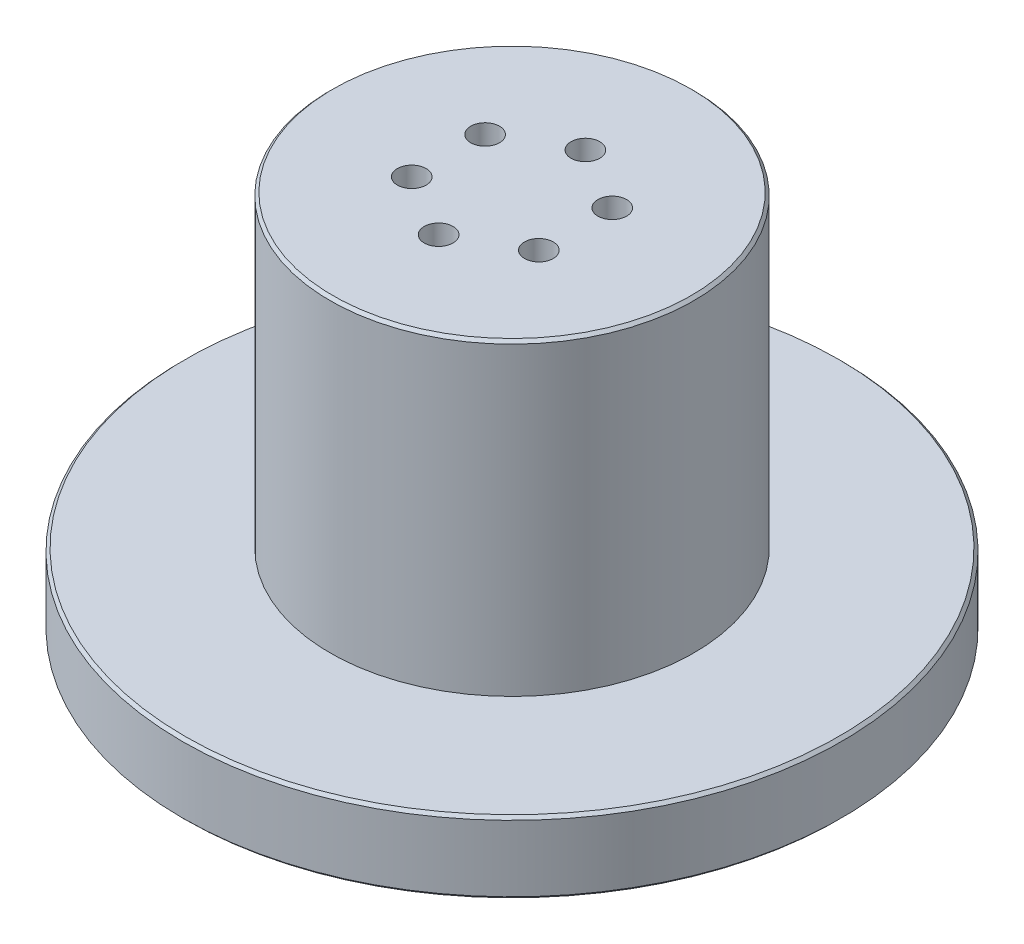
SolidWorks part; units mm, degrees
ref_plane "Plan1" through (0, 0, 0) normal (0, 0, 1) x (1, 0, 0)
ref_plane "Plan2" through (0, 0, 0) normal (0, 1, 0) x (1, 0, 0)
ref_plane "Plan3" through (0, 0, 0) normal (1, 0, 0) x (0, 0, -1)
sketch "Esquisse1" plane through (0, 0, 0) normal (0, 0, 1) x (1, 0, 0)
  line L0 (0, -37.4669) -> (0, 101.0404) construction
  line L1 (0, -50) -> (0, 50) construction
  line L2 (0, 0) -> (-57.25, 0)
  line L3 (-57.25, 0) -> (-57.25, 12.5)
  line L4 (-57.25, 12.5) -> (-31.6, 12.5)
  line L5 (-31.6, 12.5) -> (-31.6, 66)
  line L6 (-31.6, 66) -> (0, 66)
  line L7 (0, 66) -> (0, 0)
  line L8 (50, 0) -> (-50, 0) construction
  dimension "D1" = 114.5
  dimension "D2" = 12.5
  dimension "D3" = 63.2
  dimension "D4" = 66
revolve "Révolution1" add sketch "Esquisse1" angle 360 about L0
hole_wizard "Trou taraudé M61" positions "Esquisse3" profile "Esquisse2" tap size "M6" standard "ISO"
sketch "Esquisse3" plane through (0, 66, 0) normal (0, 1, 0) x (-1, 0, 0)
  circle A0 centre (0, 0) radius 12.75
  point P0 (0, 12.75)
  dimension "D1" = 25.5
sketch "Esquisse2" plane through (0, 66, 12.75) normal (1, 0, 0) x (0, 0, 1)
  line L0 (0, 0) -> (0, 18.5022)
  line L1 (0, 18.5022) -> (2.5, 17)
  line L2 (2.5, 17) -> (2.5, 0)
  line L5 (2.5, 0) -> (0, 0)
  line L10 (0, 18.5022) -> (-2.5, 17) construction
  line L11 (0, -6.35) -> (0, 107.95) construction
  dimension "Diamètre du trou pour taraudage" = 5
  dimension "Profondeur du trou pour taraudage" = 17
  dimension "Angle de pointe" = 118
pattern_circular "Répétition circulaire1" count 6 over 360 about axis through (0, 0, 0) along (0, 1, 0) of "Trou taraudé M61"
chamfer "Chanfrein1" distance 0.5 angle 45 3 edges at (0, 12.5, -57.25) (0, 0, -57.25) (0, 66, -31.6)
